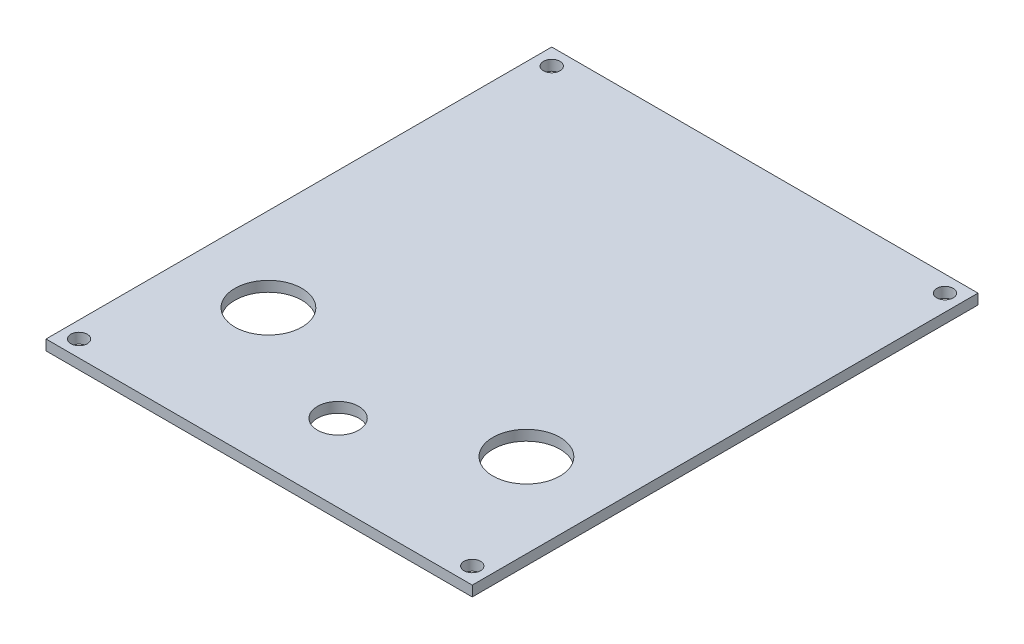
SolidWorks part; units mm, degrees
ref_plane "Front Plane" through (0, 0, 0) normal (0, 0, 1) x (1, 0, 0)
ref_plane "Top Plane" through (0, 0, 0) normal (0, 1, 0) x (1, 0, 0)
ref_plane "Right Plane" through (0, 0, 0) normal (1, 0, 0) x (0, 0, -1)
sketch "Sketch1" plane through (0, 0, 0) normal (0, 1, 0) x (1, 0, 0)
  line L1 (41.3, 49) -> (-41.3, 49)
  line L2 (41.3, 49) -> (41.3, -49)
  line L3 (41.3, -49) -> (-41.3, -49)
  line L4 (-41.3, 49) -> (-41.3, -49)
  line L5 (41.3, 49) -> (-41.3, -49) construction
  line L6 (41.3, -49) -> (-41.3, 49) construction
  point P0 (0, 0)
  dimension "D1" = 82.6
  dimension "D2" = 98
extrude "Boss-Extrude1" add sketch "Sketch1" along normal blind 2
hole_wizard "Ø3.2 (3.2) Diameter Hole1" positions "Sketch3" profile "Sketch2" hole size "Ø3.2" standard "ISO"
sketch "Sketch3" plane through (0, 2, 0) normal (0, 1, 0) x (1, 0, 0)
  line L0 (-41.3, 49) -> (-41.3, -49) construction
  line L1 (41.3, 49) -> (-41.3, 49) construction
  line L2 (41.3, -49) -> (41.3, 49) construction
  line L3 (-41.3, -49) -> (41.3, -49) construction
  point P0 (-38.1, 45.8)
  point P2 (38.1, 45.8)
  point P4 (38.1, -45.8)
  point P6 (-38.1, -45.8)
  dimension "D1" = 3.2
  dimension "D2" = 3.2
  dimension "D3" = 3.2
  dimension "D4" = 3.2
  dimension "D5" = 3.2
  dimension "D6" = 3.2
  dimension "D7" = 3.2
  dimension "D8" = 3.2
sketch "Sketch2" plane through (-38.1, 2, -45.8) normal (1, 0, 0) x (0, 0, 1)
  line L0 (0, 0) -> (0, 2)
  line L1 (0, 2) -> (1.6, 2)
  line L2 (1.6, 2) -> (1.6, 0)
  line L5 (1.6, 0) -> (0, 0)
  line L11 (0, -6.35) -> (0, 107.95) construction
  dimension "Thru Hole Dia." = 3.2
  dimension "Thru Hole Depth" = 2
sketch "Sketch4" plane through (0, 2, 0) normal (0, 1, 0) x (1, 0, 0)
  line L0 (-41.3, -49) -> (41.3, -49) construction
  line L3 (-41.3, 49) -> (-41.3, -49) construction
  circle A0 centre (-25, -22.2) radius 6.5
  circle A1 centre (25, -22.2) radius 6.5
  dimension "D1" = 13
  dimension "D2" = 13
  dimension "D3" = 26.8
  dimension "D4" = 50
  dimension "D6" = 16.3
extrude "Cut-Extrude1" cut sketch "Sketch4" against normal blind 2
sketch "Sketch6" plane through (0, 2, 0) normal (0, 1, 0) x (1, 0, 0)
  line L0 (-41.3, -49) -> (41.3, -49) construction
  line L1 (41.3, -49) -> (41.3, 49) construction
  circle A0 centre (0.3, -34) radius 4
  dimension "D1" = 8
  dimension "D2" = 15
  dimension "D3" = 41
extrude "Cut-Extrude2" cut sketch "Sketch6" against normal blind 10
